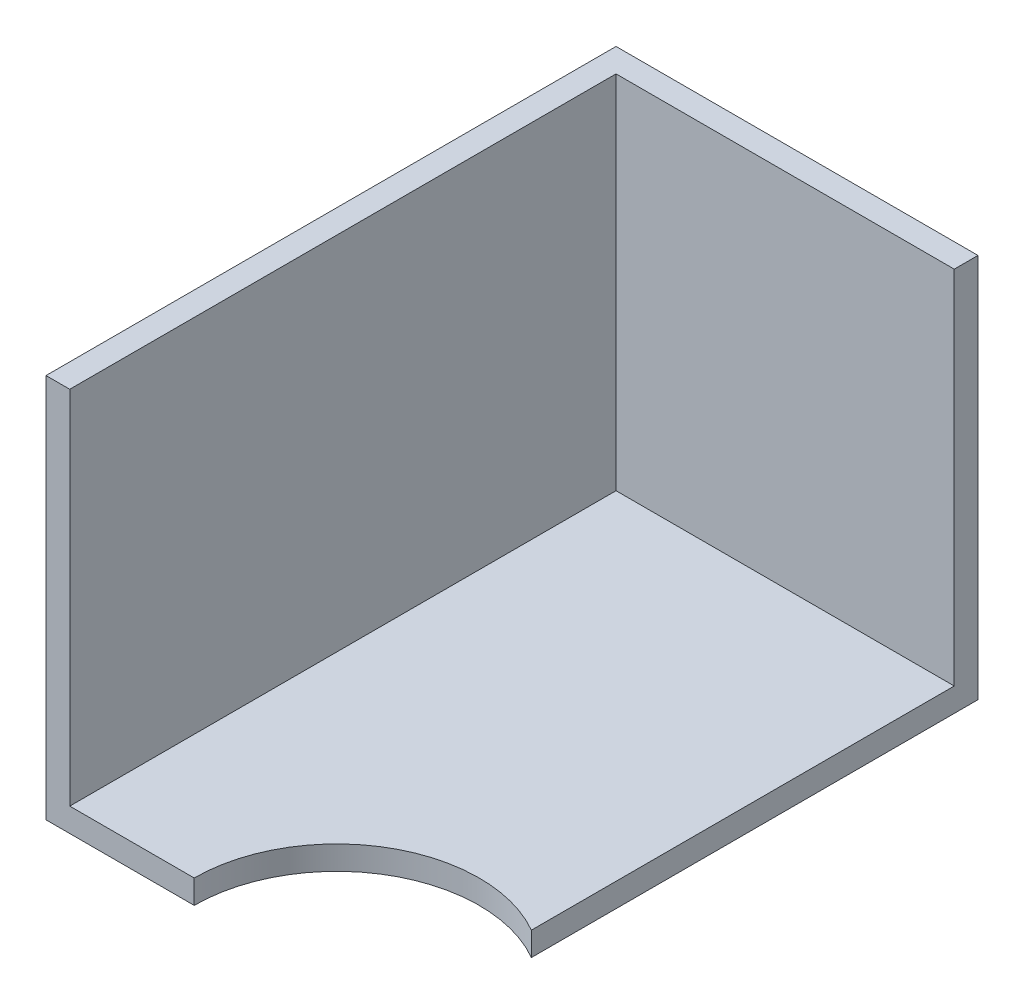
SolidWorks part; units mm, degrees
ref_plane "Front Plane" through (0, 0, 0) normal (0, 0, 1) x (1, 0, 0)
ref_plane "Top Plane" through (0, 0, 0) normal (0, 1, 0) x (1, 0, 0)
ref_plane "Right Plane" through (0, 0, 0) normal (1, 0, 0) x (0, 0, -1)
sketch "Sketch1" plane through (0, 0, 0) normal (0, 1, 0) x (1, 0, 0)
  line L1 (38.1, -60) -> (-38.1, -60)
  line L2 (38.1, -60) -> (38.1, 60)
  line L3 (38.1, 60) -> (-38.1, 60)
  line L4 (-38.1, -60) -> (-38.1, 60)
  line L5 (38.1, -60) -> (-38.1, 60) construction
  line L6 (38.1, 60) -> (-38.1, -60) construction
  point P0 (0, 0)
  dimension "D1" = 76.2
  dimension "D2" = 120
extrude "Boss-Extrude1" add sketch "Sketch1" along normal blind 5
sketch "Sketch2" plane through (0, 5, 0) normal (0, 1, 0) x (1, 0, 0)
  line L0 (-38.1, -60) -> (-38.1, 60)
  line L1 (-38.1, 60) -> (38.1, 60)
  line L2 (38.1, 60) -> (38.1, 55)
  line L3 (38.1, -60) -> (38.1, 60) construction
  line L4 (38.1, 55) -> (-33.1, 55)
  line L5 (-33.1, 55) -> (-33.1, -60)
  line L6 (-38.1, -60) -> (38.1, -60) construction
  line L7 (-33.1, -60) -> (-38.1, -60)
  dimension "D1" = 5
  dimension "D2" = 5
extrude "Boss-Extrude2" add sketch "Sketch2" along normal blind 76
sketch "Sketch3" plane through (0, 5, 0) normal (0, 1, 0) x (1, 0, 0)
  line L0 (-33.1, -60) -> (38.1, -60) construction
  circle A0 centre (38.1, -60) radius 3000
  circle A1 centre (23.1, -60) radius 30
  dimension "D1" = 15
extrude "Cut-Extrude1" cut sketch "Sketch3" against normal through all contours A1
mirror "Mirror1" [suppressed]
